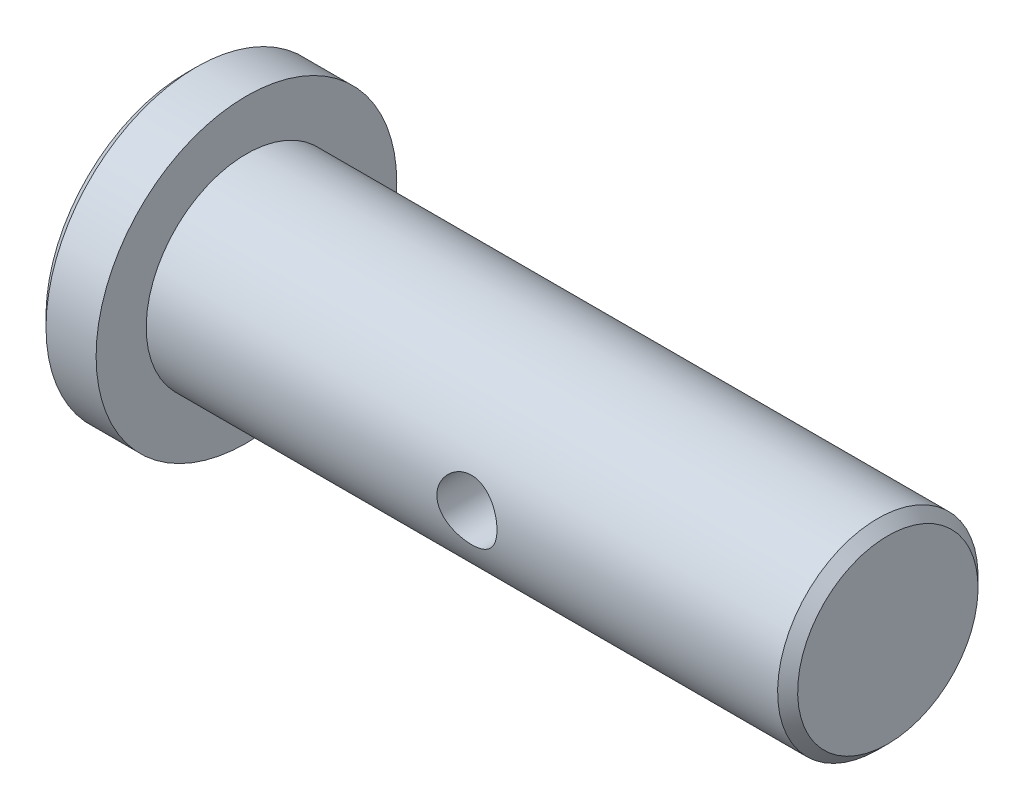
SolidWorks part; units mm, degrees
ref_plane "Face" through (0, 0, 0) normal (0, 0, 1) x (1, 0, 0)
ref_plane "Dessus" through (0, 0, 0) normal (0, 1, 0) x (1, 0, 0)
ref_plane "Droite" through (0, 0, 0) normal (1, 0, 0) x (0, 0, -1)
sketch "Esquisse1" plane through (0, 0, 0) normal (0, 0, 1) x (1, 0, 0)
  line L0 (0, 0) -> (140, 0) construction
  line L1 (0, 0) -> (0, 15)
  line L2 (0, 15) -> (6, 15)
  line L3 (6, 15) -> (6, 10)
  line L4 (6, 10) -> (70, 10)
  line L5 (70, 10) -> (70, 0)
  line L6 (70, 0) -> (0, 0)
  dimension "D1" = 20
  dimension "D2" = 30
  dimension "D3" = 6
  dimension "D4" = 70
revolve "Révolution1" add sketch "Esquisse1" angle 360 about L0
chamfer "Chanfrein1" distance 1 angle 45 1 edges at (70, -10, 0)
chamfer "Chanfrein2" distance 1 angle 45 1 edges at (0, -15, 0)
sketch "Esquisse2" plane through (0, 0, 0) normal (0, 0, 1) x (1, 0, 0)
  line L0 (6, -15) -> (6, 15) construction
  circle A0 centre (38, 0) radius 3
  dimension "D1" = 6
  dimension "D2" = 32
extrude "Enlèv. mat.-Extru.1" cut sketch "Esquisse2" against normal mid plane 20
